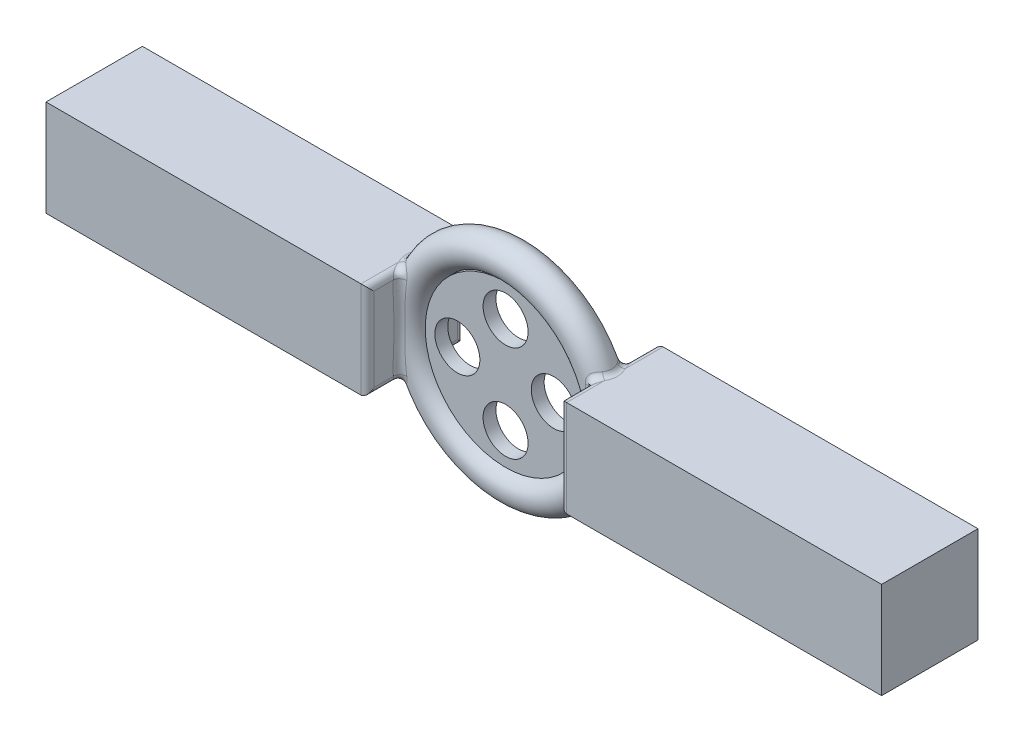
SolidWorks part; units mm, degrees
ref_plane "Front Plane" through (0, 0, 0) normal (0, 0, 1) x (1, 0, 0)
ref_plane "Top Plane" through (0, 0, 0) normal (0, 1, 0) x (1, 0, 0)
ref_plane "Right Plane" through (0, 0, 0) normal (1, 0, 0) x (0, 0, -1)
sketch "Sketch1" plane through (0, 0, 0) normal (0, 1, 0) x (1, 0, 0)
  line L0 (0, -210.8616) -> (0, 210.8616) construction
  circle A0 centre (-150, 0) radius 25
  point P4 (0, 0)
  dimension "D1" = 150
  dimension "D2" = 50
revolve "Revolve1" add sketch "Sketch1" angle 360 about L0
ref_plane "Plane1" through (150, 0, 0) normal (1, 0, 0) x (0, 0, -1)
sketch "Sketch4" plane through (150, 0, 0) normal (1, 0, 0) x (0, 0, -1)
  line L1 (-75, -75) -> (75, -75)
  line L2 (-75, -75) -> (-75, 75)
  line L3 (-75, 75) -> (75, 75)
  line L4 (75, -75) -> (75, 75)
  line L5 (-75, -75) -> (75, 75) construction
  line L6 (-75, 75) -> (75, -75) construction
  point P0 (0, 0)
  dimension "D1" = 150
  dimension "D2" = 150
extrude "Boss-Extrude2" add sketch "Sketch4" along normal blind 500
ref_plane "Plane2" through (-150, 0, 0) normal (1, 0, 0) x (0, 0, -1)
sketch "Sketch5" plane through (-150, 0, 0) normal (1, 0, 0) x (0, 0, -1)
  line L1 (75, -75) -> (-75, -75)
  line L2 (75, -75) -> (75, 75)
  line L3 (75, 75) -> (-75, 75)
  line L4 (-75, -75) -> (-75, 75)
  line L5 (75, -75) -> (-75, 75) construction
  line L6 (75, 75) -> (-75, -75) construction
  point P0 (0, 0)
extrude "Boss-Extrude3" add sketch "Sketch5" against normal blind 500
fillet "Fillet1" radius 10 20 edges at (157.7876, -75, 3.8276) (100.1228, 75, -2.2145) (-100.0233, -75, -0.9658) (-100.1228, 75, -2.2145) (150, 75, 46.3251) (150, 0, 75) (150, -75, 46.3251) (150, 44.4653, 24.1531) (150, -45.2103, -24.0951) (150, -75, -46.3251) (150, 0, -75) (150, 75, -46.3251) (-150, 75, -46.3251) (-150, 0, -75) (-150, -75, -46.3251) (-150, 44.4653, -24.1531) (-150, -45.2103, 24.0951) (-150, -75, 46.3251) (-150, 0, 75) (-150, 75, 46.3251)
sketch "Sketch6" plane through (0, 0, 0) normal (0, 0, 1) x (1, 0, 0)
  circle A0 centre (0, 0) radius 125
extrude "Boss-Extrude4" add sketch "Sketch6" along normal mid plane 20 separate body
sketch "Sketch7" plane through (0, 0, 10) normal (0, 0, 1) x (1, 0, 0)
  circle A0 centre (0, 0) radius 75
  circle A1 centre (0, 75) radius 35
  circle A2 centre (75, 0) radius 35
  circle A3 centre (0, -75) radius 35
  circle A4 centre (-75, 0) radius 35
  dimension "D1" = 4
extrude "Cut-Extrude1" cut sketch "Sketch7" against normal through all contours A1 | A4 | A3 | A2
